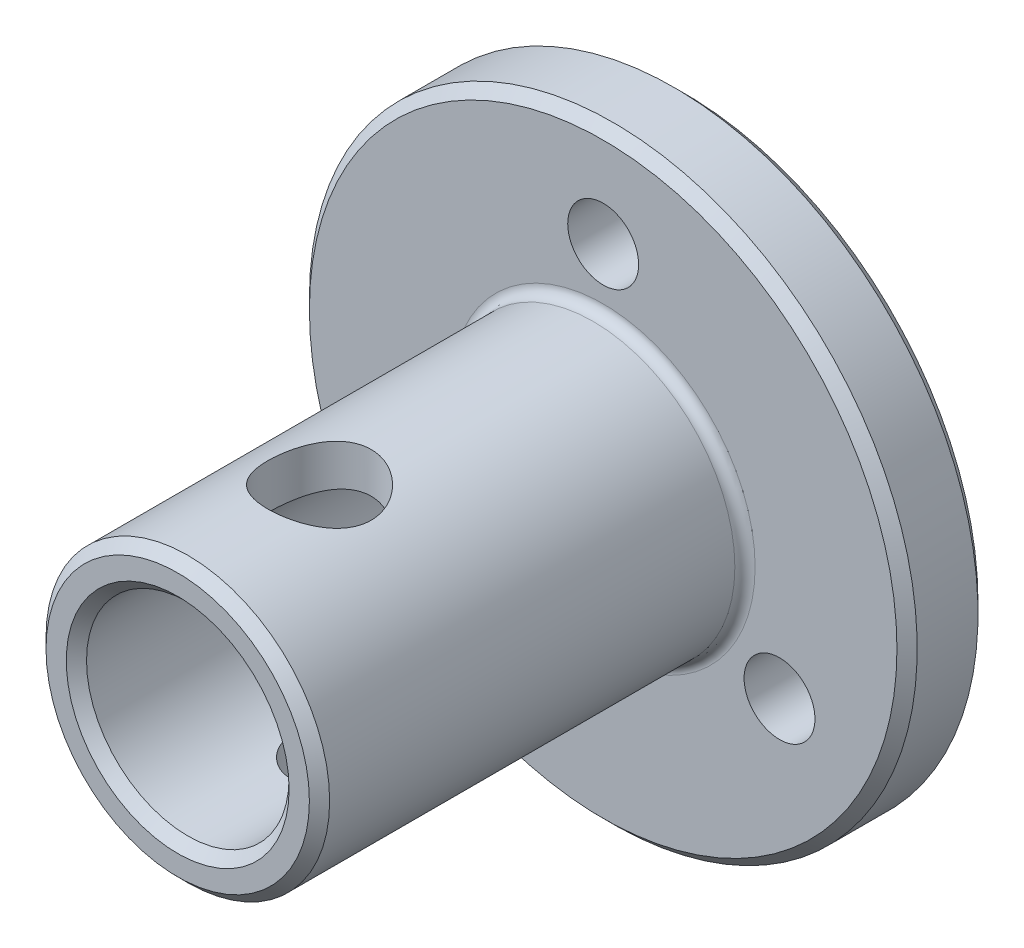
SolidWorks part; units mm, degrees
extrude "Base-Extrusion" add sketch "Esquisse1" along normal blind 42
sketch "Esquisse1" plane through (0, 0, 0) normal (0, 0, 1) x (1, 0, 0)
  circle A0 centre (0, 0) radius 14
  dimension "D1" = 28
extrude "Boss.-Extru.1" add sketch "Esquisse2" along normal blind 8
sketch "Esquisse2" plane through (0, 0, 0) normal (0, 0, -1) x (-1, 0, 0)
  circle A0 centre (0, 0) radius 30
  dimension "D1" = 60
ref_plane "Plan1" through (0, 0, 0) normal (0, 0, 1) x (1, 0, 0)
ref_plane "Plan2" through (0, 0, 0) normal (0, 1, 0) x (1, 0, 0)
ref_plane "Plan3" through (0, 0, 0) normal (1, 0, 0) x (0, 0, -1)
sketch "Esquisse5" plane through (0, 0, -8) normal (0, 0, -1) x (-1, 0, 0)
  circle A0 centre (0, 0) radius 10
  dimension "D1" = 20
extrude "Enlèv. mat.-Extru.1" cut sketch "Esquisse5" against normal through all
chamfer "Chanfrein1" distance 1 angle 45
chamfer "Chanfrein2" distance 1 angle 45
sketch "Esquisse6" plane through (0, 0, -8) normal (0, 0, -1) x (-1, 0, 0)
  circle A0 centre (0, 20.1) radius 3.5
  dimension "D1" = 7
  dimension "D2" = 20.1
extrude "Enlèv. mat.-Extru.2" cut sketch "Esquisse6" against normal through all
pattern_circular "Répétition circulaire1" count 3 every 120
sketch "Esquisse7" plane through (0, 0, 0) normal (1, 0, 0) x (0, -1, 0)
  line L0 (-21.3, -28) -> (33, -28) construction
  line L1 (-14, 0) -> (-14, -41) construction
  line L2 (-16.3, -22.9) -> (-3.3643, -22.9)
  line L4 (-3.3643, -22.9) -> (-3.3643, -25)
  line L5 (-3.3643, -25) -> (17.4071, -25)
  line L7 (17.4071, -25) -> (17.4071, -28)
  line L8 (17.4071, -28) -> (-16.3, -28)
  line L9 (-16.3, -28) -> (-16.3, -22.9)
  line L11 (29, 8) -> (-29, 8) construction
  dimension "D1" = 36
  dimension "D2" = 3
  dimension "D3" = 5.1
  dimension "D4" = 2.3
  dimension "D5" = 33.7071
  dimension "D6" = 12.9357
revolve "Enlever de la matière-Révolution1" cut sketch "Esquisse7" angle 360 about L0
fillet "Congé1" radius 1
